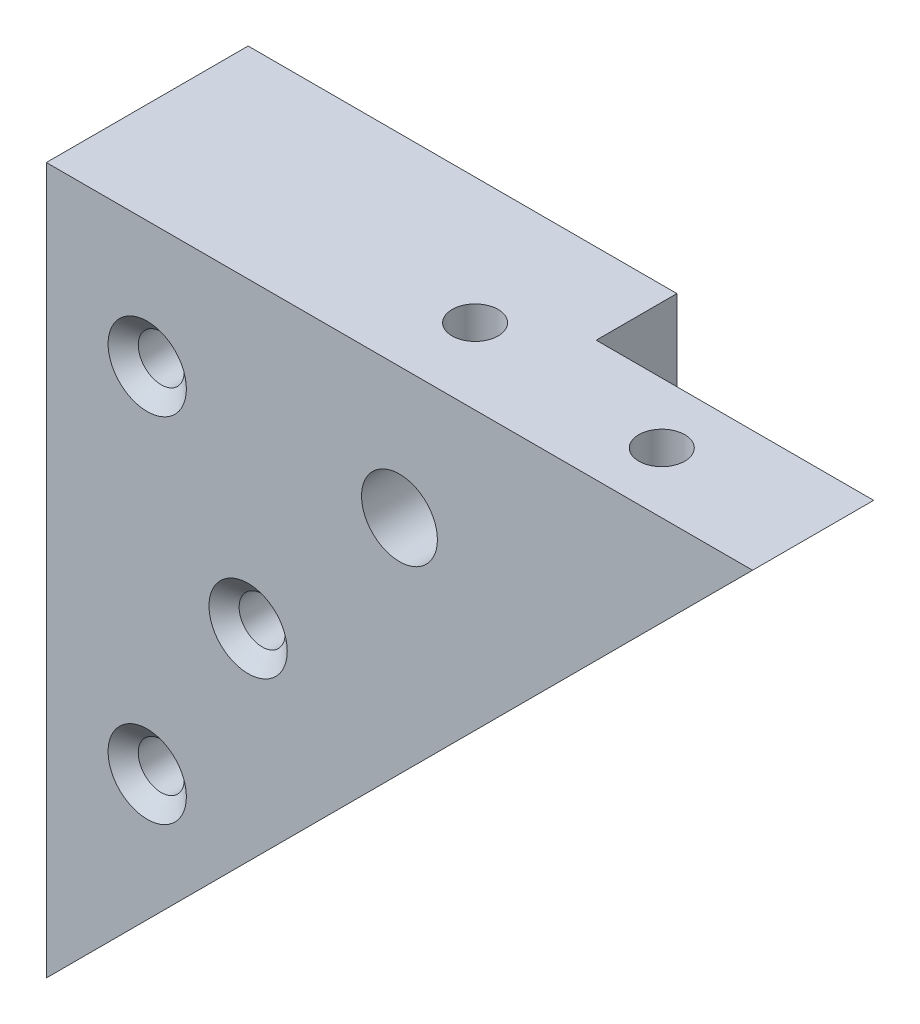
SolidWorks part; units mm, degrees
ref_plane "Front Plane" through (0, 0, 0) normal (0, 0, 1) x (1, 0, 0)
ref_plane "Top Plane" through (0, 0, 0) normal (0, 1, 0) x (1, 0, 0)
ref_plane "Right Plane" through (0, 0, 0) normal (1, 0, 0) x (0, 0, -1)
sketch "Sketch2" plane through (0, 0, 0) normal (0, 0, 1) x (1, 0, 0)
  line L0 (0, 88.9) -> (0, 0)
  line L1 (0, 0) -> (88.9, 88.9)
  line L2 (88.9, 88.9) -> (0, 88.9)
extrude "Extrude1" add sketch "Sketch2" along normal blind 25.4
sketch "Sketch3" plane through (0, 88.9, 0) normal (0, 1, 0) x (-1, 0, 0)
  line L0 (-88.9, 10.16) -> (-53.975, 10.16)
  line L1 (-88.9, 25.4) -> (-88.9, 0) construction
  line L2 (-53.975, 10.16) -> (-53.975, 0)
  line L3 (-88.9, 0) -> (0, 0) construction
  line L4 (-53.975, 0) -> (-88.9, 0)
  line L5 (-88.9, 0) -> (-88.9, 10.16)
extrude "Cut-Extrude1" cut sketch "Sketch3" against normal through all
sketch "Sketch4" plane through (0, 0, 25.4) normal (0, 0, 1) x (1, 0, 0)
  circle A0 centre (44.45, 72.39) radius 4.7752
extrude "Cut-Extrude2" cut sketch "Sketch4" against normal through all
sketch "Sketch5" plane through (0, 88.9, 0) normal (0, 1, 0) x (-1, 0, 0)
  circle A0 centre (-69.85, 17.78) radius 2.8956
extrude "Cut-Extrude3" cut sketch "Sketch5" against normal through all
sketch "Sketch6" plane through (0, 88.9, 0) normal (0, 1, 0) x (-1, 0, 0)
  circle A3 centre (-69.85, 17.78) radius 6.6294
extrude "Cut-Extrude4" cut sketch "Sketch6" against normal blind 19.05 from offset 12.7
sketch "Sketch7" plane through (0, 0, 25.4) normal (0, 0, 1) x (1, 0, 0)
  circle A0 centre (12.7, 73.025) radius 2.8956
  circle A1 centre (12.7, 28.575) radius 2.8956
  circle A2 centre (25.4, 50.8) radius 2.8956
extrude "Cut-Extrude5" cut sketch "Sketch7" against normal through all
chamfer "Chamfer1" distance 2.032 angle 41 3 edges at (15.5956, 28.575, 25.4) (15.5956, 73.025, 25.4) (28.2956, 50.8, 25.4)
sketch "Sketch9" plane through (0, 88.9, 0) normal (0, 1, 0) x (-1, 0, 0)
  circle A0 centre (-44.45, 15.875) radius 2.8956
extrude "Cut-Extrude7" cut sketch "Sketch9" against normal blind 25.4
